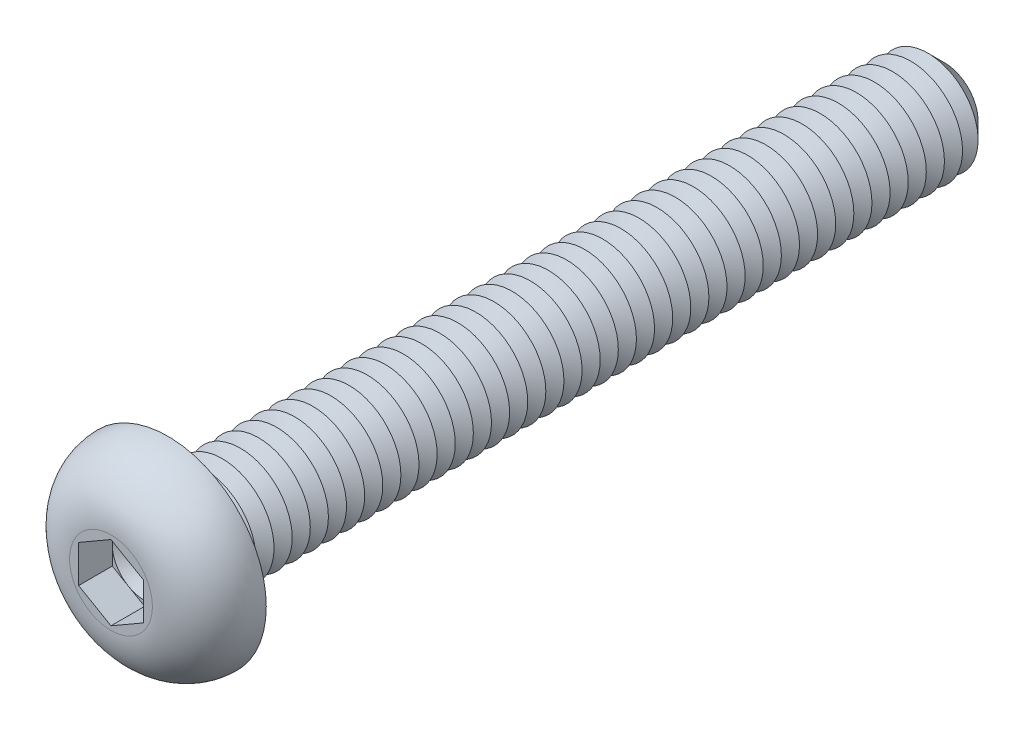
SolidWorks part; units mm, degrees
ref_plane "Front Plane" through (0, 0, 0) normal (0, 0, 1) x (1, 0, 0)
ref_plane "Top Plane" through (0, 0, 0) normal (0, 1, 0) x (1, 0, 0)
ref_plane "Right Plane" through (0, 0, 0) normal (1, 0, 0) x (0, 0, -1)
sketch "Sketch1" plane through (0, 0, 0) normal (1, 0, 0) x (0, 0, -1)
  line L0 (-47.9342, 0) -> (60.3146, 0) construction
sketch "Sketch2" plane through (0, 0, 0) normal (1, 0, 0) x (0, 0, -1)
  line L0 (0, 0) -> (-2.2, 0)
  line L1 (-47.9342, 0) -> (60.3146, 0) construction
  line L2 (-2.2, 0) -> (-2.2, 1.6)
  line L3 (0, 3.8) -> (0, 0)
  arc A0 (-2.2, 1.6) -> (0, 3.8) centre (0, 1.6) cw
  dimension "D1" = 2.2
  dimension "D2" = 2.2
  dimension "D3" = 3.8
revolve "Revolve1" add sketch "Sketch2" angle 360 about L0
sketch "Sketch3" plane through (0, 0, 2.2) normal (0, 0, 1) x (1, 0, 0)
  line L1 (0, 1.4434) -> (-1.25, 0.7217)
  line L2 (-1.25, 0.7217) -> (-1.25, -0.7217)
  line L3 (-1.25, -0.7217) -> (0, -1.4434)
  line L4 (0, -1.4434) -> (1.25, -0.7217)
  line L5 (1.25, -0.7217) -> (1.25, 0.7217)
  line L6 (1.25, 0.7217) -> (0, 1.4434)
  circle A0 centre (0, 0) radius 1.25 construction
  dimension "D1" = 2.5
extrude "Cut-Extrude1" cut sketch "Sketch3" against normal blind 1.3
sketch "Sketch4" plane through (0, 0, 0) normal (0, 0, -1) x (-1, 0, 0)
  circle A0 centre (0, 0) radius 2
  dimension "D1" = 4
extrude "Boss-Extrude1" add sketch "Sketch4" along normal blind 30
chamfer "Chamfer1" distance 0.7 angle 45 1 edges at (-2, 0, -30)
sketch "Sketch5" plane through (0, 0, 0) normal (1, 0, 0) x (0, 0, -1)
  line L0 (0.7, 2) -> (1.4, 2)
  line L1 (29.3, 2) -> (0, 2) construction
  line L2 (1.4, 2) -> (1.05, 1.3938)
  line L3 (1.05, 1.3938) -> (0.7, 2)
  line L4 (0, -3.8) -> (0, 3.8) construction
  line L5 (29.3, 2) -> (0, 2) construction
  dimension "D1" = 0.7
  dimension "D2" = 0.7
revolve "Cut-Revolve1" cut sketch "Sketch5" angle 360 about L0
pattern_linear "LPattern1" count 41 spacing 0.7 along (0, 0, -1) of "Cut-Revolve1"
fillet "Fillet2" radius 0.3 1 edges at (2, 0, 0)
sketch "Sketch6" plane through (0, 0, 0.9) normal (0, 0, 1) x (1, 0, 0)
  line L0 (0, -1.4434) -> (1.25, -0.7217) construction
  circle A0 centre (0, 0) radius 1.25
extrude "Cut-Extrude2" cut sketch "Sketch6" against normal through all draft 60
